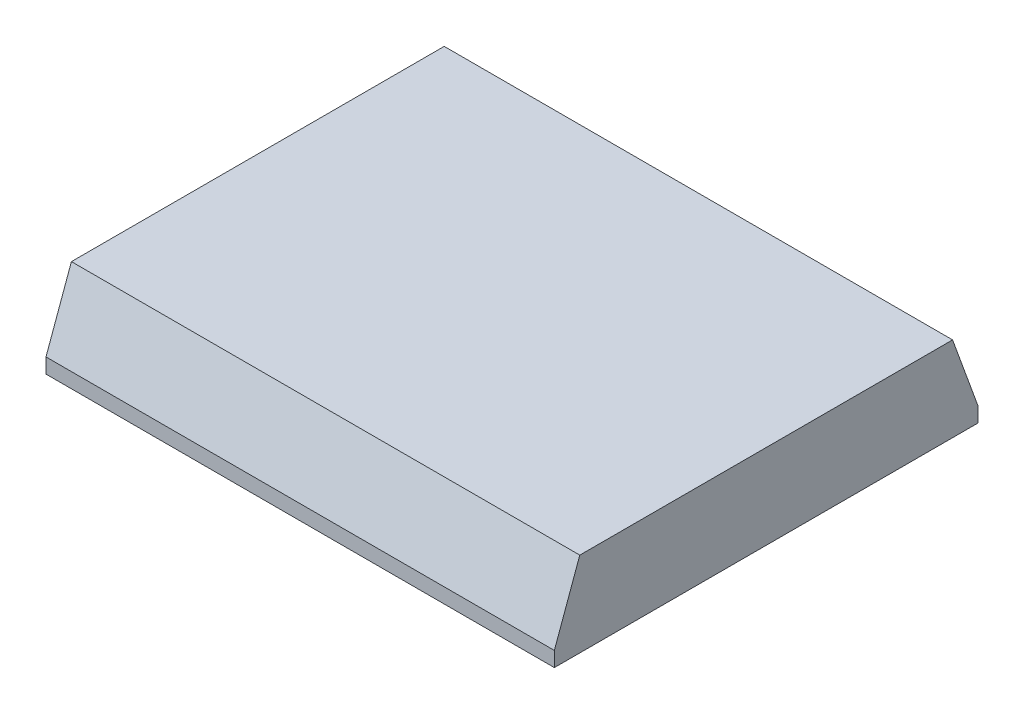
SolidWorks part; units mm, degrees
ref_plane "Front Plane" through (0, 0, 0) normal (0, 0, 1) x (1, 0, 0)
ref_plane "Top Plane" through (0, 0, 0) normal (0, 1, 0) x (1, 0, 0)
ref_plane "Right Plane" through (0, 0, 0) normal (1, 0, 0) x (0, 0, -1)
sketch "Sketch1" plane through (0, 0, 0) normal (1, 0, 0) x (0, 0, -1)
  line L1 (-25, -5) -> (25, -5)
  line L2 (-25, -5) -> (-25, 5)
  line L3 (-25, 5) -> (25, 5)
  line L4 (25, -5) -> (25, 5)
  line L5 (-25, -5) -> (25, 5) construction
  line L6 (-25, 5) -> (25, -5) construction
  point P0 (0, 0)
  dimension "D1" = 50
  dimension "D2" = 10
extrude "Boss-Extrude1" add sketch "Sketch1" along normal blind 60
chamfer "Chamfer1" distance 3 angle 70 1 edges at (30, 5, 25)
chamfer "Chamfer2" distance 3 angle 70 1 edges at (30, 5, -25)
